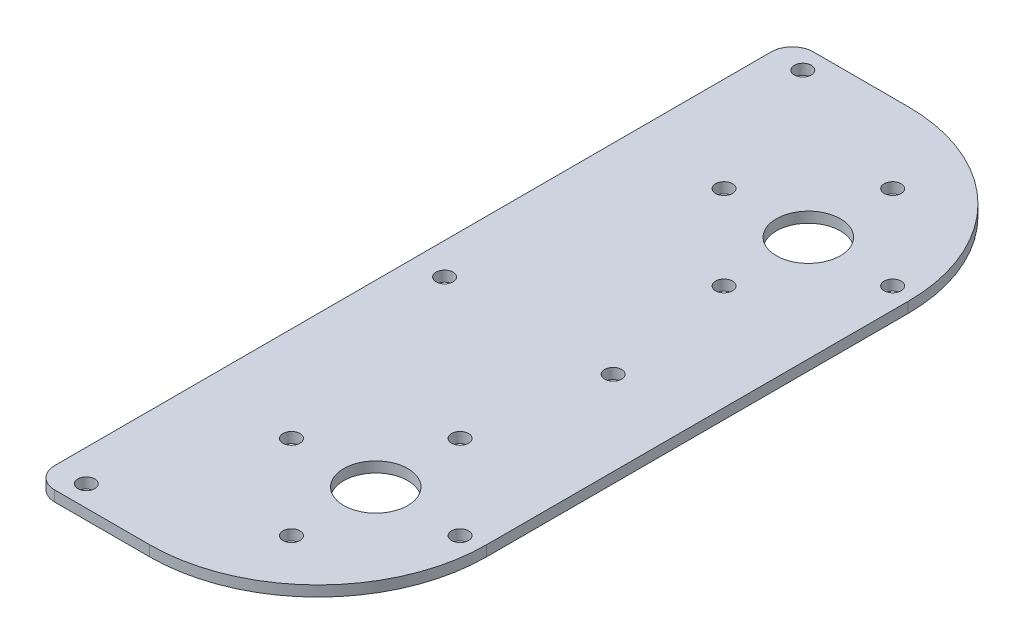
SolidWorks part; units mm, degrees
ref_plane "Front Plane" through (0, 0, 0) normal (0, 0, 1) x (1, 0, 0)
ref_plane "Top Plane" through (0, 0, 0) normal (0, 1, 0) x (1, 0, 0)
ref_plane "Right Plane" through (0, 0, 0) normal (1, 0, 0) x (0, 0, -1)
sketch "Sketch1" plane through (0, 0, 0) normal (0, 1, 0) x (1, 0, 0)
  line L0 (0, 6.35) -> (0, 222.25)
  line L1 (6.35, 228.6) -> (44.45, 228.6)
  line L3 (6.35, 0) -> (44.45, 0)
  line L7 (95.25, 50.8) -> (95.25, 177.8)
  arc A2 (0, 6.35) -> (6.35, 0) centre (6.35, 6.35) ccw
  arc A6 (0, 222.25) -> (6.35, 228.6) centre (6.35, 222.25) cw
  circle A7 centre (63.5, 179.4764) radius 9.652
  circle A8 centre (63.5, 49.1236) radius 9.652
  circle A9 centre (63.5, 179.4764) radius 50.8 construction
  circle A10 centre (63.5, 49.1236) radius 50.8 construction
  arc A11 (95.25, 177.8) -> (44.45, 228.6) centre (44.45, 177.8) ccw
  arc A12 (44.45, 0) -> (95.25, 50.8) centre (44.45, 50.8) ccw
  point P14 (0, 0)
  point P23 (0, 228.6)
  dimension "D2" = 101.6
  dimension "D6" = 6.35
  dimension "D7" = 19.304
  dimension "D8" = 101.6
  dimension "D10" = 50.8
  dimension "D1" = 228.6
  dimension "D3" = 49.1236
  dimension "D4" = 49.1236
  dimension "D5" = 63.5
  dimension "D9" = 95.25
extrude "Boss-Extrude1" add sketch "Sketch1" along normal blind 3.175
hole_wizard "#7 (0.201) Diameter Hole1" positions "Sketch2" profile "Sketch3" hole size "#7" standard "ANSI Inch"
sketch "Sketch2" plane through (0, 3.175, 0) normal (0, 1, 0) x (1, 0, 0)
  line L0 (0, 222.25) -> (0, 6.35) construction
  line L1 (44.45, 228.6) -> (6.35, 228.6) construction
  line L2 (6.35, 0) -> (44.45, 0) construction
  point P0 (6.35, 222.25)
  point P2 (19.05, 222.25)
  point P4 (19.05, 114.3)
  point P6 (69.85, 114.3)
  point P8 (6.35, 6.35)
  point P10 (19.05, 6.35)
  dimension "D1" = 12.7
  dimension "D2" = 6.35
  dimension "D3" = 6.35
  dimension "D4" = 6.35
  dimension "D5" = 114.3
  dimension "D6" = 19.05
  dimension "D7" = 50.8
sketch "Sketch3" plane through (6.35, 3.175, -222.25) normal (1, 0, 0) x (0, 0, 1)
  line L0 (0, 0) -> (0, 3.175)
  line L1 (0, 3.175) -> (2.5527, 3.175)
  line L2 (2.5527, 3.175) -> (2.5527, 0)
  line L5 (2.5527, 0) -> (0, 0)
  line L11 (0, -6.35) -> (0, 107.95) construction
  dimension "Thru Hole Dia." = 5.1054
  dimension "Thru Hole Depth" = 3.175
hole_wizard "#7 (0.201) Diameter Hole2" positions "Sketch4" profile "Sketch5" hole size "#7" standard "ANSI Inch"
sketch "Sketch4" plane through (0, 3.175, 0) normal (0, 1, 0) x (1, 0, 0)
  circle A0 centre (63.5, 179.4764) radius 25.4 construction
  circle A1 centre (63.5, 49.1236) radius 25.4 construction
  point P0 (63.5, 204.8764)
  point P2 (38.1, 179.4764)
  point P4 (88.9, 179.4764)
  point P6 (63.5, 154.0764)
  point P8 (63.5, 74.5236)
  point P10 (38.1, 49.1236)
  point P12 (88.9, 49.1236)
  point P14 (63.5, 23.7236)
  dimension "D1" = 50.8
sketch "Sketch5" plane through (63.5, 3.175, -204.8764) normal (1, 0, 0) x (0, 0, 1)
  line L0 (0, 0) -> (0, 3.175)
  line L1 (0, 3.175) -> (2.5527, 3.175)
  line L2 (2.5527, 3.175) -> (2.5527, 0)
  line L5 (2.5527, 0) -> (0, 0)
  line L11 (0, -6.35) -> (0, 107.95) construction
  dimension "Thru Hole Dia." = 5.1054
  dimension "Thru Hole Depth" = 3.175
sketch "Sketch6" plane through (0, 3.175, 0) normal (0, 1, 0) x (1, 0, 0)
  line L0 (9.525, 228.6) -> (9.525, 0)
  line L1 (44.45, 228.6) -> (6.35, 228.6) construction
  line L2 (6.35, 0) -> (44.45, 0) construction
  line L3 (0, 222.25) -> (0, 6.35) construction
  line L4 (6.35, 0) -> (9.525, 0)
  line L5 (9.525, 228.6) -> (6.35, 228.6)
  line L6 (0, 222.25) -> (0, 6.35)
  arc A0 (6.35, 228.6) -> (0, 222.25) centre (6.35, 222.25) ccw construction
  arc A1 (0, 6.35) -> (6.35, 0) centre (6.35, 6.35) ccw construction
  arc A2 (6.35, 228.6) -> (0, 222.25) centre (6.35, 222.25) ccw
  arc A3 (0, 6.35) -> (6.35, 0) centre (6.35, 6.35) ccw
  dimension "D1" = 9.525
extrude "Cut-Extrude1" cut sketch "Sketch6" against normal through all
fillet "Fillet1" radius 6.35 2 edges at (9.525, 1.5875, 0) (9.525, 1.5875, -228.6)
